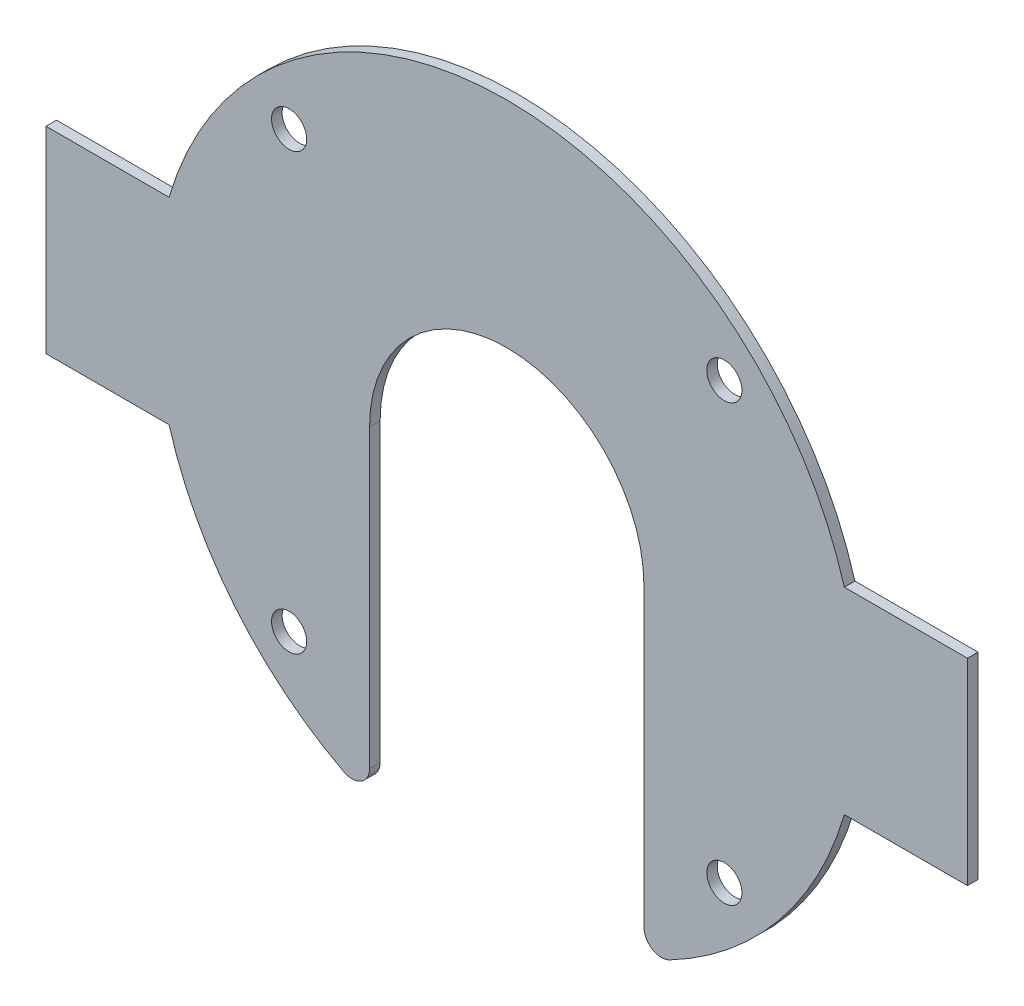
SolidWorks part; units mm, degrees
ref_plane "Plan de face" through (0, 0, 0) normal (0, 0, 1) x (1, 0, 0)
ref_plane "Plan de dessus" through (0, 0, 0) normal (0, 1, 0) x (1, 0, 0)
ref_plane "Plan de droite" through (0, 0, 0) normal (1, 0, 0) x (0, 0, -1)
sketch "Esquisse1" plane through (0, 0, 0) normal (0, 0, 1) x (1, 0, 0)
  line L0 (-164.8492, 0) -> (146.9795, 0) construction
  line L1 (96, 28) -> (131, 28)
  line L2 (131, 28) -> (131, -28)
  line L3 (131, -28) -> (96, -28)
  line L4 (-96, 28) -> (-131, 28)
  line L5 (-131, 28) -> (-131, -28)
  line L6 (-131, -28) -> (-96, -28)
  line L7 (-39, 0) -> (-39, -84.1962)
  line L8 (39, 0) -> (39, -84.1962)
  line L9 (0, 0) -> (88.1787, 88.1787) construction
  line L10 (0, 0) -> (-85.0136, 85.0136) construction
  line L11 (0, 0) -> (-82.904, -82.904) construction
  line L12 (0, 0) -> (81.8742, -81.8742) construction
  arc A0 (-96, -28) -> (-46.3158, -88.6276) centre (0, 0) ccw
  arc A1 (96, 28) -> (-96, 28) centre (0, 0) ccw
  arc A2 (39, 0) -> (-39, 0) centre (0, 0) ccw
  arc A3 (46.3158, -88.6276) -> (96, -28) centre (0, 0) ccw
  arc A4 (46.3158, -88.6276) -> (39, -84.1962) centre (44, -84.1962) cw
  arc A5 (-39, -84.1962) -> (-46.3158, -88.6276) centre (-44, -84.1962) cw
  circle A6 centre (61.8718, 61.8718) radius 5
  circle A7 centre (-61.8718, 61.8718) radius 5
  circle A8 centre (-61.8718, -61.8718) radius 5
  circle A9 centre (61.8718, -61.8718) radius 5
  point P18 (39, -92.0815)
  dimension "D1" = 200
  dimension "D7" = 39
  dimension "D8" = 5
  dimension "D11" = 10
  dimension "D12" = 87.5
  dimension "D13" = 87.5
  dimension "D14" = 87.5
  dimension "D15" = 87.5
  dimension "D2" = 56
  dimension "D3" = 28
  dimension "D4" = 56
  dimension "D5" = 131
  dimension "D6" = 131
  dimension "D9" = 45
  dimension "D10" = 90
extrude "Boss.-Extru.1" add sketch "Esquisse1" along normal blind 3
